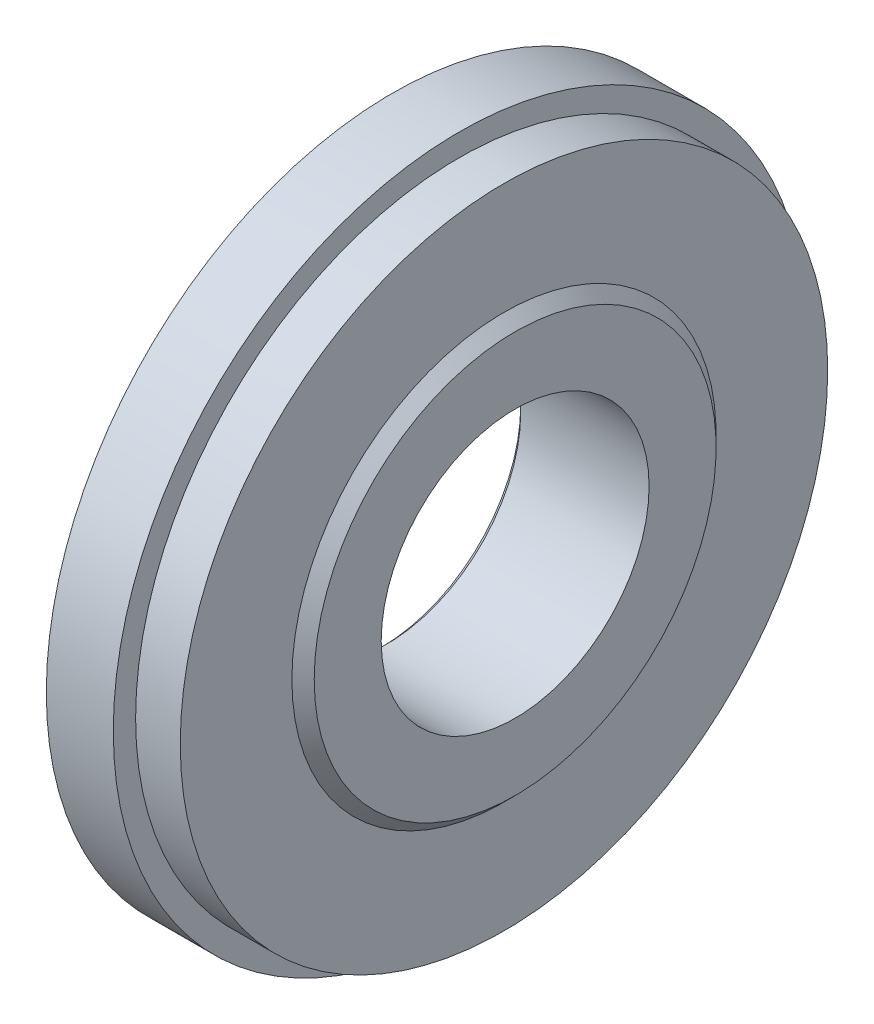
SolidWorks part; units mm, degrees
ref_plane "Plane1" through (0, 0, 0) normal (0, 0, 1) x (1, 0, 0)
ref_plane "Plane2" through (0, 0, 0) normal (0, 1, 0) x (1, 0, 0)
ref_plane "Plane3" through (0, 0, 0) normal (1, 0, 0) x (0, 0, -1)
sketch "Esquisse1" plane through (0, 0, 0) normal (0, 0, 1) x (1, 0, 0)
  line L0 (0, 12) -> (0, 16)
  line L1 (0, 16) -> (5, 16)
  line L2 (7, 18) -> (7, 26)
  line L3 (5, 28) -> (1, 28)
  line L4 (1, 28) -> (1, 31)
  line L5 (1, 31) -> (7, 31)
  line L6 (7, 31) -> (7, 29)
  line L7 (7, 29) -> (11, 29)
  line L8 (11, 29) -> (11, 19)
  line L9 (11, 19) -> (12, 18)
  line L10 (12, 18) -> (12, 12)
  line L11 (12, 12) -> (0, 12)
  line L12 (-8, 0) -> (18, 0) construction
  arc A0 (7, 18) -> (5, 16) centre (5, 18) cw
  arc A1 (5, 28) -> (7, 26) centre (5, 26) cw
  dimension "D1" = 2
  dimension "D2" = 12
  dimension "D3" = 11
  dimension "D4" = 1
  dimension "D5" = 6
  dimension "D6" = 29
  dimension "D7" = 31
  dimension "D8" = 28
  dimension "D9" = 12
  dimension "D10" = 16
  dimension "D11" = 6
revolve "Base-Révolution" add sketch "Esquisse1" angle 360 about L12
chamfer "Chanfrein1" distance 0.5 angle 45
